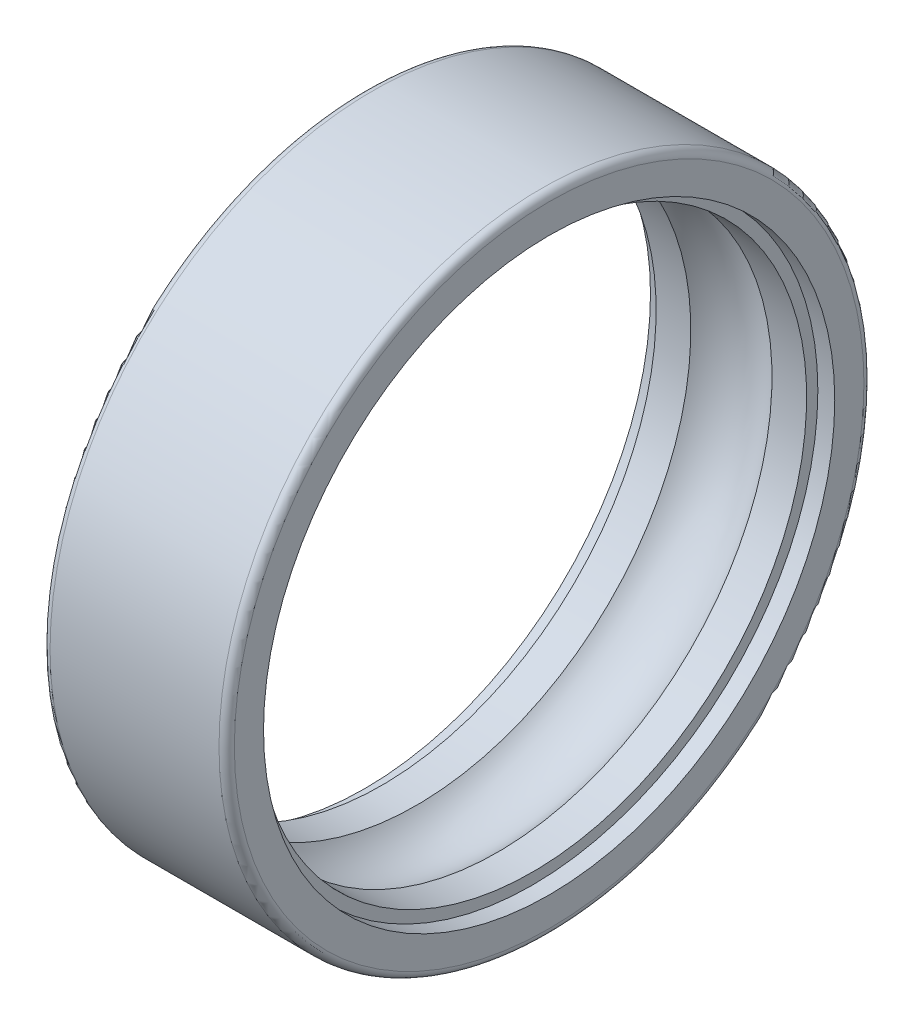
SolidWorks part; units mm, degrees
ref_plane "Face" through (0, 0, 0) normal (0, 0, 1) x (1, 0, 0)
ref_plane "Dessus" through (0, 0, 0) normal (0, 1, 0) x (1, 0, 0)
ref_plane "Droite" through (0, 0, 0) normal (1, 0, 0) x (0, 0, -1)
sketch "Esquisse1" plane through (0, 0, 0) normal (0, 0, 1) x (1, 0, 0)
  line L0 (-18.2873, 0) -> (21.3038, 0) construction
  line L1 (0, 36.5746) -> (0, -35.8205) construction
  line L2 (2.643, 17.87) -> (4.9, 17.87)
  line L3 (-5.5, 21) -> (5.5, 21)
  line L4 (-6, 20.5) -> (-6, 18.6)
  line L5 (-4.9, 17.87) -> (-2.643, 17.87)
  line L6 (6, 20.5) -> (6, 18.6)
  line L7 (-6, 18.6) -> (-4.9, 18.6)
  line L8 (-4.9, 18.6) -> (-4.9, 17.87)
  line L13 (4.9, 18.6) -> (4.9, 17.87)
  line L14 (6, 18.6) -> (4.9, 18.6)
  arc A0 (2.643, 17.87) -> (-2.643, 17.87) centre (0, 15.5) ccw
  arc A1 (-5.5, 21) -> (-6, 20.5) centre (-5.5, 20.5) ccw
  arc A2 (5.5, 21) -> (6, 20.5) centre (5.5, 20.5) cw
  dimension "D3" = 7.1
  dimension "D5" = 1.18
  dimension "D6" = 0.5
  dimension "D1" = 42
  dimension "D2" = 12
  dimension "D4" = 15.5
  dimension "D7" = 37.2
  dimension "D8" = 1.1
revolve "Base-Révolution" add sketch "Esquisse1" angle 360 about L0
